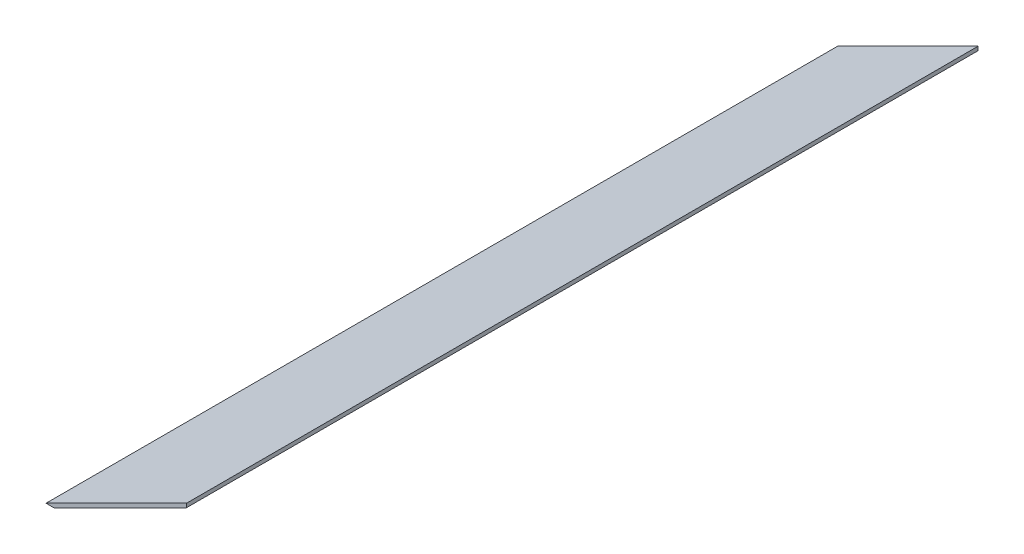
SolidWorks part; units mm, degrees
ref_plane "Front" through (0, 0, 0) normal (0, 0, 1) x (1, 0, 0)
ref_plane "Top" through (0, 0, 0) normal (0, 1, 0) x (1, 0, 0)
ref_plane "Right" through (0, 0, 0) normal (1, 0, 0) x (0, 0, -1)
sketch "草图2" plane through (0, 0, 0) normal (0, 0, 1) x (1, 0, 0)
  line L2 (-28.9222, -11.2575) -> (11.1856, 8.7964)
  line L3 (-28.9222, -11.2575) -> (-26.6861, -11.2575)
  line L4 (11.1856, 7.6784) -> (-26.6861, -11.2575)
  line L5 (11.1856, 8.7964) -> (11.1856, 7.6784)
  dimension "D1" = 180
extrude "凸台-拉伸1" add sketch "草图2" along normal blind 226
